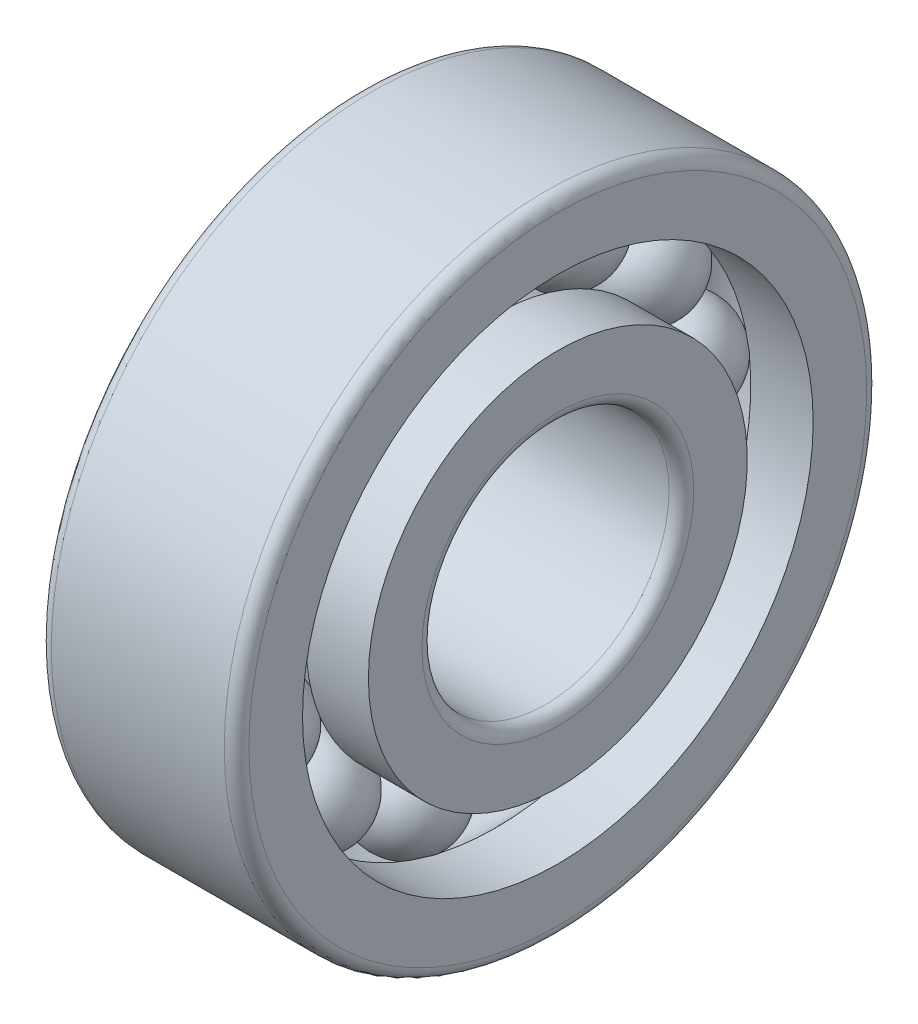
SolidWorks part; units mm, degrees
ref_plane "Front" through (0, 0, 0) normal (0, 0, 1) x (1, 0, 0)
ref_plane "Top" through (0, 0, 0) normal (0, 1, 0) x (1, 0, 0)
ref_plane "Right" through (0, 0, 0) normal (1, 0, 0) x (0, 0, -1)
other "Configuration Table"
sketch "Sketch1" plane through (0, 0, 0) normal (0, 0, 1) x (1, 0, 0)
  line L0 (-9.6833, 0) -> (9.8371, 0) construction
  line L1 (-2, 9) -> (2, 9)
  line L2 (-4.5966, 9) -> (4.6657, 9) construction
  arc A0 (2, 9) -> (-2, 9) centre (0, 9) ccw
revolve "Revolve1" add sketch "Sketch1" angle 360 about L2
sketch "Sketch2" plane through (0, 0, 0) normal (0, 0, 1) x (1, 0, 0)
  line L0 (-4, 7.6667) -> (-4, 5)
  line L1 (-4, 5) -> (4, 5)
  line L2 (4, 5) -> (4, 7.6667)
  line L3 (4, 7.6667) -> (1.4773, 7.6667)
  line L4 (-6.9714, 0) -> (8.1665, 0) construction
  line L5 (-6.7058, 9) -> (6.7058, 9) construction
  line L6 (-1.4773, 7.6667) -> (-4, 7.6667)
  arc A0 (-1.4773, 7.6667) -> (1.4773, 7.6667) centre (0, 9) ccw
revolve "Revolve2" add sketch "Sketch2" angle 360 about L4
sketch "Sketch3" plane through (0, 0, 0) normal (0, 0, 1) x (1, 0, 0)
  line L0 (-8.7107, 0) -> (9.1288, 0) construction
  line L1 (-4, 13) -> (4, 13)
  line L2 (-4, 13) -> (-4, 10.3333)
  line L3 (-4, 10.3333) -> (-1.4773, 10.3333)
  line L4 (4, 13) -> (4, 10.3333)
  line L5 (-7.2948, 9) -> (7.2948, 9) construction
  line L6 (1.4773, 10.3333) -> (4, 10.3333)
  arc A0 (1.4773, 10.3333) -> (-1.4773, 10.3333) centre (0, 9) ccw
revolve "Revolve3" add sketch "Sketch3" angle 360 about L0
pattern_circular "Circular-Pattern1" count 13 over 360 about axis through (0, 0, 0) along (1, 0, 0) of "Revolve1"
fillet "Fillet1" radius 0.5 4 edges at (-4, 0, 5) (-4, 0, 13) (4, 0, 13) (4, 0, 5)
equation "\"d0@Sketch1\" = ( \"DD@Sketch3\" + \"d@Sketch2\" )  / 2"
equation "\"dia@Sketch1\" =  ( \"DD@Sketch3\" - \"d@Sketch2\" )  / 4"
equation "\"D3@Sketch2\" = ( \"DD@Sketch3\" + \"d@Sketch2\" )  / 2 / 2"
equation "\"D4@Sketch2\" = ( \"DD@Sketch3\" - \"d@Sketch2\" )  / 6"
equation "\"D5@Sketch2\" = \"dia@Sketch1\" - 0.02"
equation "\"B/2@Sketch2\" = \"B@Sketch2\" / 2"
equation "\"D4@Sketch3\" = ( \"DD@Sketch3\" + \"d@Sketch2\" )  / 2 / 2"
equation "\"D5@Sketch3\" = ( \"DD@Sketch3\" - \"d@Sketch2\" )  / 6"
equation "\"B@Sketch3\" = \"B@Sketch2\""
equation "\"B/2@Sketch3\" = \"B@Sketch3\" / 2"
equation "\"D1@Sketch3\" = \"dia@Sketch1\" - 0.02"
equation "\"m@Circular-Pattern1\" = int( 3.14159265 / atn(( \"dia@Sketch1\" / 2) / sqr(( \"DD@Sketch3\" + \"d@Sketch2\" )  / 2 * ( \"DD@Sketch3\" + \"d@Sketch2\" )  / 2/4 - ( \"dia@Sketch1\" / 2) *  ( \"dia@Sketch1\" / 2))))-1"
